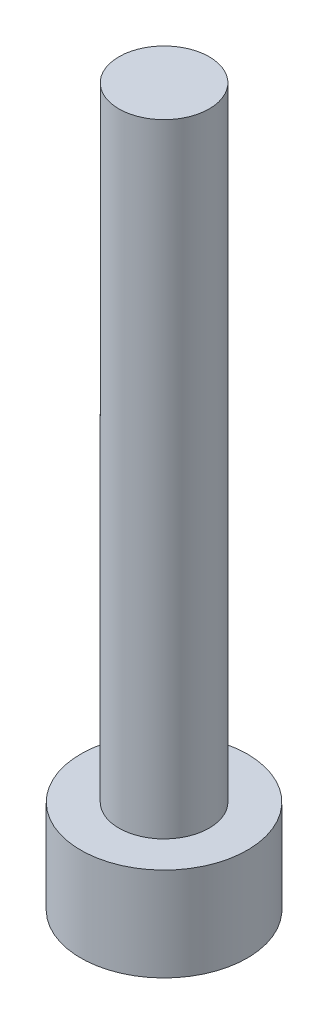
SolidWorks part; units mm, degrees
ref_plane "Front Plane" through (0, 0, 0) normal (0, 0, 1) x (1, 0, 0)
ref_plane "Top Plane" through (0, 0, 0) normal (0, 1, 0) x (1, 0, 0)
ref_plane "Right Plane" through (0, 0, 0) normal (1, 0, 0) x (0, 0, -1)
sketch "Sketch1" plane through (0, 0, 0) normal (0, 1, 0) x (1, 0, 0)
  circle A0 centre (0, 0) radius 1.45
extrude "Boss-Extrude1" add sketch "Sketch1" along normal blind 20
sketch "Sketch2" plane through (0, 0, 0) normal (0, -1, 0) x (1, 0, 0)
  circle A0 centre (0, 0) radius 2.675
extrude "Boss-Extrude2" add sketch "Sketch2" along normal blind 3
sketch "Sketch3" plane through (0, -3, 0) normal (0, -1, 0) x (1, 0, 0)
  line L1 (1.6619, 0.4878) -> (0.4085, 1.6832)
  line L2 (0.4085, 1.6832) -> (-1.2534, 1.1954)
  line L3 (-1.2534, 1.1954) -> (-1.6619, -0.4878)
  line L4 (-1.6619, -0.4878) -> (-0.4085, -1.6832)
  line L5 (-0.4085, -1.6832) -> (1.2534, -1.1954)
  line L6 (1.2534, -1.1954) -> (1.6619, 0.4878)
  circle A0 centre (0, 0) radius 1.5 construction
extrude "Cut-Extrude1" cut sketch "Sketch3" against normal blind 2
